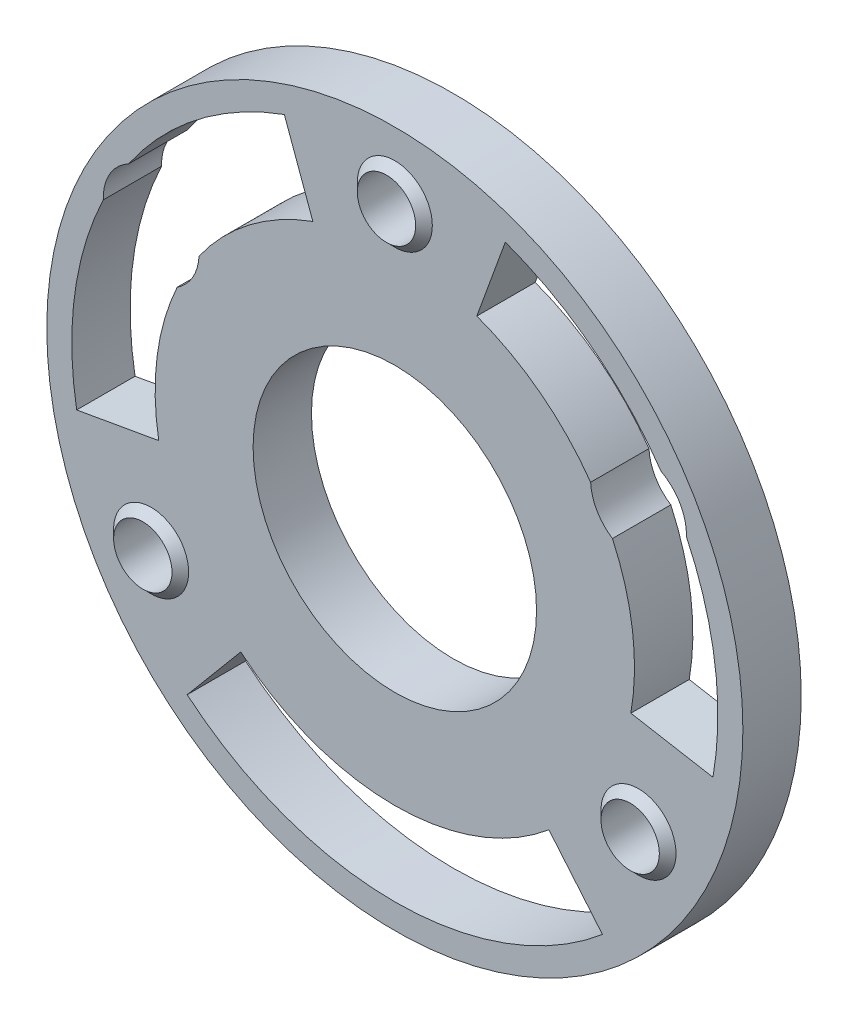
SolidWorks part; units mm, degrees
ref_plane "Front Plane" through (0, 0, 0) normal (0, 0, 1) x (1, 0, 0)
ref_plane "Top Plane" through (0, 0, 0) normal (0, 1, 0) x (1, 0, 0)
ref_plane "Right Plane" through (0, 0, 0) normal (1, 0, 0) x (0, 0, -1)
sketch "Sketch1" plane through (0, 0, 0) normal (0, 0, 1) x (1, 0, 0)
  line L0 (0, 0) -> (14.6142, -8.4375) construction
  line L1 (0, 0) -> (-14.6142, -8.4375) construction
  line L2 (0, -55) -> (0, 55) construction
  line L3 (0, 0) -> (-6.6266, 18.2065) construction
  line L4 (0, 0) -> (-19.0807, -3.3644) construction
  line L5 (-19.0807, -3.3644) -> (-14.1566, -2.4962)
  line L6 (-6.6266, 18.2065) -> (-4.9165, 13.5081)
  line L7 (19.0807, -3.3644) -> (14.1566, -2.4962)
  line L8 (6.6266, 18.2065) -> (4.9165, 13.5081)
  line L9 (-12.454, -14.8421) -> (-9.2401, -11.0119)
  line L10 (12.454, -14.8421) -> (9.2401, -11.0119)
  circle A0 centre (0, 0) radius 8.5
  circle A1 centre (0, 0) radius 14.375 construction
  circle A2 centre (0, 0) radius 16.875 construction
  circle A3 centre (0, 0) radius 19.375 construction
  circle A4 centre (0, 0) radius 20.875
  circle A5 centre (0, 16.875) radius 1.75
  circle A6 centre (-14.6142, -8.4375) radius 1.75
  circle A7 centre (14.6142, -8.4375) radius 1.75
  arc A8 (-14.1566, -2.4962) -> (-4.9165, 13.5081) centre (0, 0) cw
  arc A9 (-19.0807, -3.3644) -> (-6.6266, 18.2065) centre (0, 0) cw
  arc A10 (4.9165, 13.5081) -> (14.1566, -2.4962) centre (0, 0) cw
  arc A11 (6.6266, 18.2065) -> (19.0807, -3.3644) centre (0, 0) cw
  arc A12 (9.2401, -11.0119) -> (-9.2401, -11.0119) centre (0, 0) cw
  arc A13 (12.454, -14.8421) -> (-12.454, -14.8421) centre (0, 0) cw
  point P31 (0, 0)
  dimension "D1" = 17
  dimension "D2" = 2.5
  dimension "D3" = 33.75
  dimension "D4" = 2.5
  dimension "D5" = 4
  dimension "D8" = 3.5
  dimension "D6" = 120
  dimension "D7" = 120
  dimension "D9" = 20
  dimension "D10" = 20
  dimension "D11" = 3
extrude "Boss-Extrude1" add sketch "Sketch1" along normal blind 3.5
sketch "Sketch2" plane through (0, 0, 3.5) normal (0, 0, 1) x (1, 0, 0)
  circle A0 centre (0, 16.875) radius 2.25
  circle A1 centre (0, 16.875) radius 1.75
  circle A2 centre (-14.6142, -8.4375) radius 2.25
  circle A3 centre (-14.6142, -8.4375) radius 1.75
  circle A4 centre (14.6142, -8.4375) radius 2.25
  circle A5 centre (14.6142, -8.4375) radius 1.75
  circle A6 centre (0, 16.875) radius 1.75 construction
  dimension "D1" = 4.5
extrude "Boss-Extrude2" add sketch "Sketch2" along normal blind 0.5
sketch "Sketch3" plane through (0, 0, 0) normal (0, 0, -1) x (-1, 0, 0)
  line L0 (0, 0) -> (-14.6142, 8.4375) construction
  line L1 (0, 0) -> (14.6142, 8.4375) construction
  line L2 (0, 2.2) -> (0, -2.2) construction
  line L3 (-1.75, 16.875) -> (1.75, 16.875) construction
  circle A0 centre (0, 0) radius 16.875 construction
  circle A1 centre (-14.6142, 8.4375) radius 2.875
  circle A2 centre (14.6142, 8.4375) radius 2.875
  circle A3 centre (0, 16.875) radius 1.75 construction
  point P14 (0, 16.875)
  dimension "D4" = 5.75
  dimension "D2" = 60
  dimension "D3" = 60
extrude "Cut-Extrude1" cut sketch "Sketch3" against normal through all
chamfer "Chamfer1" distance 0.5 angle 45 3 edges at (16.8642, -8.4375, 4) (-12.3642, -8.4375, 4) (2.25, 16.875, 4)
